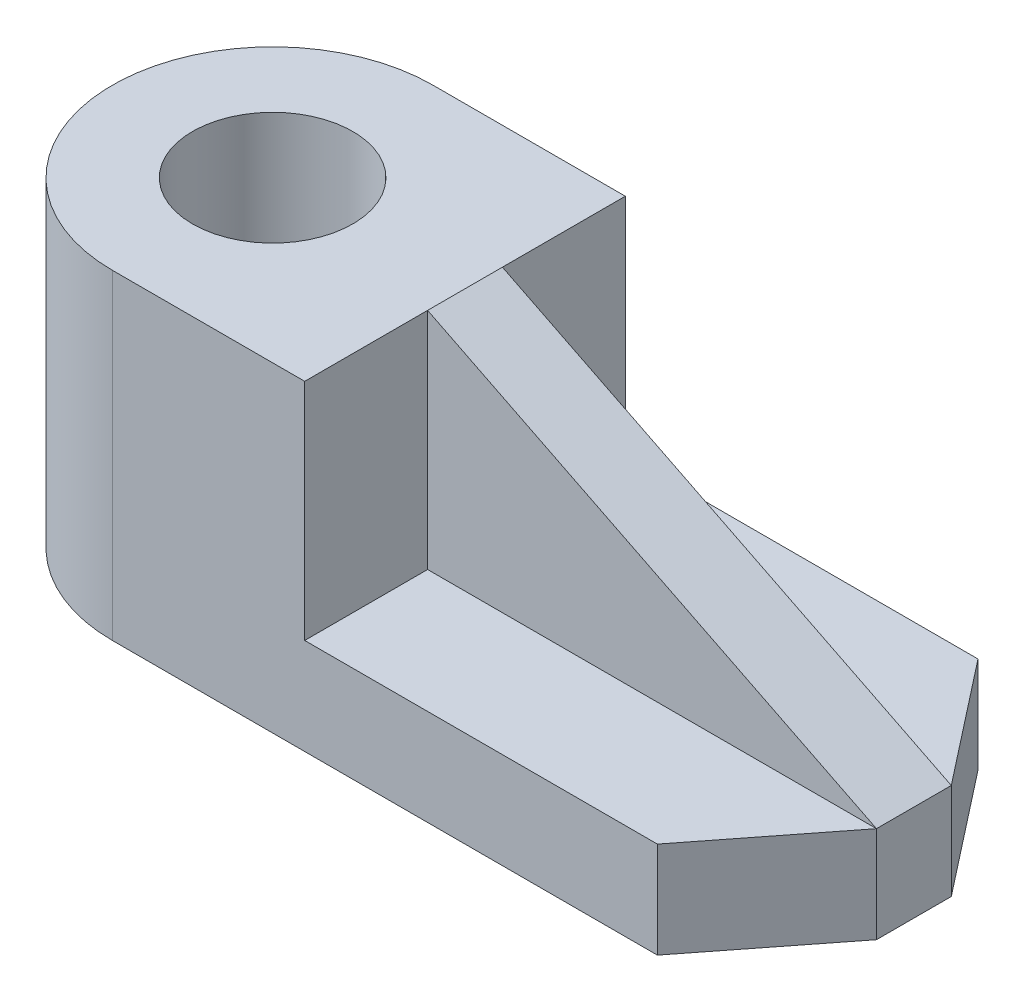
SolidWorks part; units mm, degrees
ref_plane "Alzado" through (0, 0, 0) normal (0, 0, 1) x (1, 0, 0)
ref_plane "Planta" through (0, 0, 0) normal (0, 1, 0) x (1, 0, 0)
ref_plane "Vista lateral" through (0, 0, 0) normal (1, 0, 0) x (0, 0, -1)
sketch "Croquis5" plane through (0, 0, 0) normal (0, 1, 0) x (1, 0, 0)
  line L0 (0, 15) -> (18, 15)
  line L1 (18, 15) -> (18, -15)
  line L2 (18, -15) -> (0, -15)
  line L8 (0, 0) -> (18, 0) construction
  arc A0 (0, 15) -> (0, -15) centre (0, 0) ccw
  circle A1 centre (0, 0) radius 7.5
  dimension "D1" = 30
  dimension "D3" = 15
  dimension "D2" = 18
sketch "Croquis6" plane through (0, 0, 0) normal (0, 1, 0) x (1, 0, 0)
  line L1 (18, 15) -> (18, -15)
  line L3 (18, 15) -> (51, 15)
  line L4 (51, 15) -> (60, 3.5)
  line L5 (60, 3.5) -> (60, -3.5)
  line L6 (60, -3.5) -> (51, -15)
  line L7 (51, -15) -> (18, -15)
  line L9 (18, 0) -> (60, 0) construction
  dimension "D5" = 9
  dimension "D6" = 9
  dimension "D7" = 7
extrude "Saliente-Extruir3" add sketch "Croquis5" along normal blind 30
extrude "Saliente-Extruir4" add sketch "Croquis6" along normal blind 9
sketch "Croquis8" plane through (0, 0, 0) normal (0, 0, 1) x (1, 0, 0)
  line L0 (18, 30) -> (60, 9)
  line L1 (60, 9) -> (18, 9)
  line L2 (18, 9) -> (18, 30)
extrude "Saliente-Extruir5" add sketch "Croquis8" along normal blind 3.5 and the other way blind 3.5
